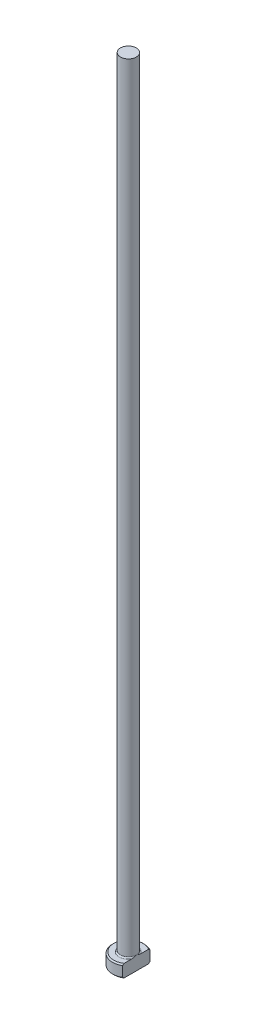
SolidWorks part; units mm, degrees
ref_plane "Front Plane" through (0, 0, 0) normal (0, 0, 1) x (1, 0, 0)
ref_plane "Top Plane" through (0, 0, 0) normal (0, 1, 0) x (1, 0, 0)
ref_plane "Right Plane" through (0, 0, 0) normal (1, 0, 0) x (0, 0, -1)
sketch "Sketch1" plane through (0, 0, 0) normal (0, 0, 1) x (1, 0, 0)
  line L0 (0, 259.9588) -> (0, -15.1925) construction
  line L1 (0, 0) -> (-2.5, 0)
  line L2 (-2.5, 0) -> (-2.5, 2)
  line L3 (-2.5, 2) -> (-1.25, 2)
  line L4 (-1.25, 2) -> (-1.25, 125)
  line L5 (-1.25, 125) -> (0, 125)
  line L6 (0, 125) -> (0, 0)
  dimension "L" = 125
  dimension "H" = 5
  dimension "T" = 2
  dimension "D" = 2.5
revolve "Revolve1" add sketch "Sketch1" angle 360 about L0
chamfer "Chamfer1" distance 0.2 angle 45 2 edges at (0, 2, 2.5) (0, 0, 2.5)
fillet "Fillet1" radius 0.2 1 edges at (0, 2, 1.25)
sketch "Sketch2" plane through (0, 0, 0) normal (0, 1, 0) x (1, 0, 0)
  line L0 (1.25, 2.1651) -> (1.25, -2.1651)
  circle A0 centre (0, 0) radius 2.5 construction
  arc A1 (1.25, -2.1651) -> (1.25, 2.1651) centre (0, 0) ccw
  circle A2 centre (0, 0) radius 1.25 construction
extrude "KEY" cut sketch "Sketch2" along normal through all
